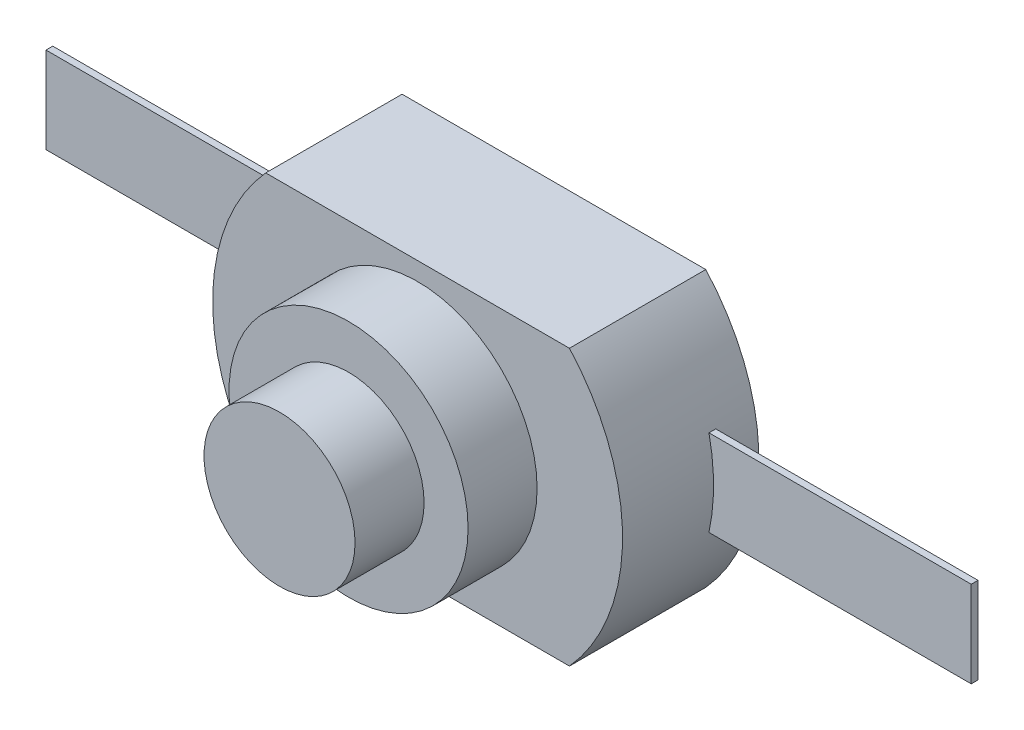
SolidWorks part; units mm, degrees
ref_plane "Front Plane" through (0, 0, 0) normal (0, 0, 1) x (1, 0, 0)
ref_plane "Top Plane" through (0, 0, 0) normal (0, 1, 0) x (1, 0, 0)
ref_plane "Right Plane" through (0, 0, 0) normal (1, 0, 0) x (0, 0, -1)
sketch "Sketch1" plane through (0, 0, 0) normal (0, 0, 1) x (1, 0, 0)
  line L0 (-6.0325, 0) -> (6.0325, 0) construction
  line L1 (-4.4697, -4.0513) -> (4.4697, -4.0513)
  line L2 (-4.4697, 4.0513) -> (4.4697, 4.0513)
  line L3 (-9.0101, 4.0513) -> (9.6947, 4.0513) construction
  line L4 (-9.0101, 0) -> (9.6947, 0) construction
  line L5 (-9.0101, -4.0513) -> (9.6947, -4.0513) construction
  arc A0 (-4.4697, 4.0513) -> (-4.4697, -4.0513) centre (0, 0) ccw
  arc A1 (4.4697, -4.0513) -> (4.4697, 4.0513) centre (0, 0) ccw
  dimension "D1" = 12.065
  dimension "D2" = 4.0513
  dimension "D3" = 4.0513
extrude "Boss-Extrude1" add sketch "Sketch1" along normal blind 4.0132
sketch "Sketch2" plane through (0, 0, 4.0132) normal (0, 0, 1) x (1, 0, 0)
  circle A0 centre (0, 0) radius 3.5179
  dimension "D1" = 7.0358
extrude "Boss-Extrude2" add sketch "Sketch2" along normal blind 2.032
sketch "Sketch3" plane through (0, 0, 6.0452) normal (0, 0, 1) x (1, 0, 0)
  circle A0 centre (0, 0) radius 2.2225
  dimension "D1" = 4.445
extrude "Boss-Extrude3" add sketch "Sketch3" along normal blind 2.032
sketch "Sketch4" plane through (0, 0, 0) normal (0, 1, 0) x (1, 0, 0)
  line L0 (0, 0) -> (0, -3.2154) construction
  line L1 (-13.6169, -1.135) -> (13.6169, -1.135)
  line L2 (-13.6169, -1.135) -> (-13.6169, -1.3342)
  line L3 (-13.6169, -1.3342) -> (13.6169, -1.3342)
  line L4 (13.6169, -1.135) -> (13.6169, -1.3342)
  point P7 (0, -1.135)
extrude "Boss-Extrude4" add sketch "Sketch4" along normal mid plane 2.54
